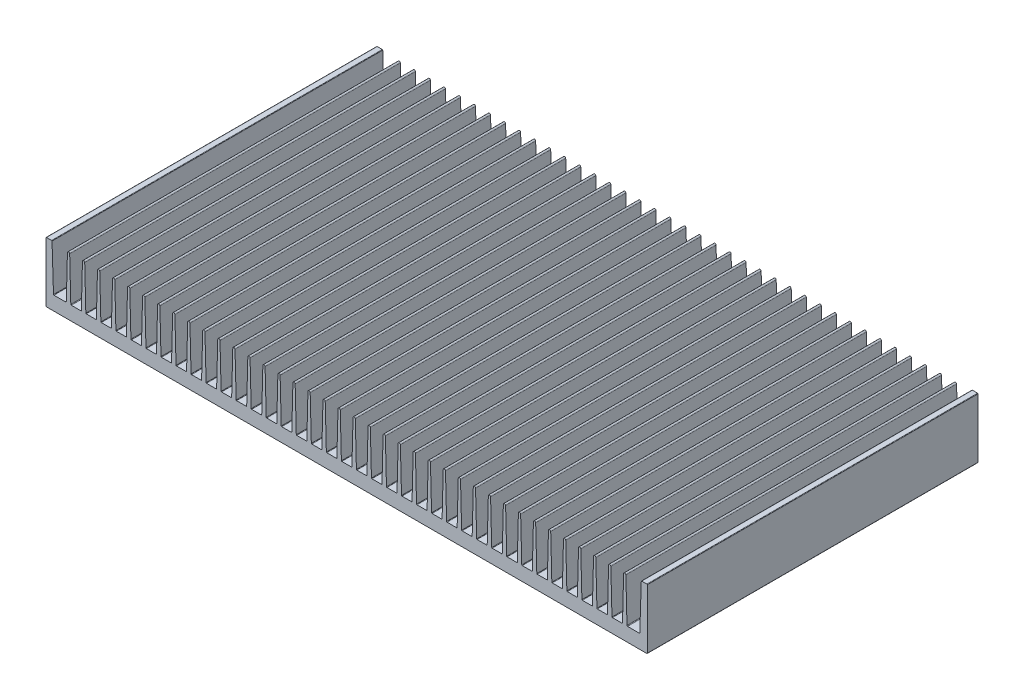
SolidWorks part; units mm, degrees
ref_plane "Vorne" through (0, 0, 0) normal (0, 0, 1) x (1, 0, 0)
ref_plane "Oben" through (0, 0, 0) normal (0, 1, 0) x (1, 0, 0)
ref_plane "Rechts" through (0, 0, 0) normal (1, 0, 0) x (0, 0, -1)
ref_plane "Ebene1" through (0, 0, 10) normal (0, 0, 1) x (1, 0, 0)
sketch "Skizze1" plane through (0, 0, 10) normal (0, 0, 1) x (1, 0, 0)
  line L0 (205.8293, 23.4383) -> (205.0866, 52.2154)
  line L1 (203.5871, 52.2154) -> (202.8444, 23.4383)
  line L2 (202.5445, 23.146) -> (196.1292, 23.146)
  line L3 (195.8293, 23.4383) -> (195.0866, 52.2154)
  line L4 (193.5871, 52.2154) -> (192.8444, 23.4383)
  line L5 (192.5445, 23.146) -> (186.1292, 23.146)
  line L6 (185.8293, 23.4383) -> (185.0866, 52.2154)
  line L7 (183.5871, 52.2154) -> (182.8444, 23.4383)
  line L8 (182.5445, 23.146) -> (176.1292, 23.146)
  line L9 (175.8293, 23.4383) -> (175.0866, 52.2154)
  line L10 (173.5871, 52.2154) -> (172.8444, 23.4383)
  line L11 (172.5445, 23.146) -> (166.1292, 23.146)
  line L12 (165.8293, 23.4383) -> (165.0866, 52.2154)
  line L13 (163.5871, 52.2154) -> (162.8444, 23.4383)
  line L14 (162.5445, 23.146) -> (156.1292, 23.146)
  line L15 (155.8293, 23.4383) -> (155.0866, 52.2154)
  line L16 (153.5871, 52.2154) -> (152.8444, 23.4383)
  line L17 (152.5445, 23.146) -> (146.1292, 23.146)
  line L18 (145.8293, 23.4383) -> (145.0866, 52.2154)
  line L19 (143.5871, 52.2154) -> (142.8444, 23.4383)
  line L20 (142.5445, 23.146) -> (136.1292, 23.146)
  line L21 (135.8293, 23.4383) -> (135.0866, 52.2154)
  line L22 (133.5871, 52.2154) -> (132.8444, 23.4383)
  line L23 (132.5445, 23.146) -> (126.1292, 23.146)
  line L24 (125.8293, 23.4383) -> (125.0866, 52.2154)
  line L25 (123.5871, 52.2154) -> (122.8444, 23.4383)
  line L26 (122.5445, 23.146) -> (116.1292, 23.146)
  line L27 (115.8293, 23.4383) -> (115.0866, 52.2154)
  line L28 (113.5871, 52.2154) -> (112.8444, 23.4383)
  line L29 (112.5445, 23.146) -> (106.1292, 23.146)
  line L30 (105.8293, 23.4383) -> (105.0866, 52.2155)
  line L31 (103.5871, 52.2154) -> (102.8444, 23.4383)
  line L32 (102.5445, 23.146) -> (96.1292, 23.146)
  line L33 (95.8293, 23.4383) -> (95.0866, 52.2154)
  line L34 (93.5871, 52.2154) -> (92.8444, 23.4383)
  line L35 (92.5445, 23.146) -> (86.1292, 23.146)
  line L36 (85.8293, 23.4383) -> (85.0866, 52.2154)
  line L37 (83.5871, 52.2154) -> (82.8444, 23.4383)
  line L38 (82.5445, 23.146) -> (76.1292, 23.146)
  line L39 (75.8293, 23.4383) -> (75.0866, 52.2154)
  line L40 (73.5871, 52.2154) -> (72.8444, 23.4383)
  line L41 (72.5445, 23.146) -> (66.1292, 23.146)
  line L42 (65.8293, 23.4383) -> (65.0866, 52.2154)
  line L43 (63.5871, 52.2154) -> (62.8444, 23.4383)
  line L44 (62.5445, 23.146) -> (56.1292, 23.146)
  line L45 (55.8293, 23.4383) -> (55.0866, 52.2154)
  line L46 (53.5871, 52.2154) -> (52.8444, 23.4383)
  line L47 (52.5445, 23.146) -> (46.1292, 23.146)
  line L48 (45.8293, 23.4383) -> (45.0866, 52.2154)
  line L49 (43.5871, 52.2154) -> (42.8444, 23.4383)
  line L50 (42.5445, 23.146) -> (36.1292, 23.146)
  line L51 (35.8293, 23.4383) -> (35.0866, 52.2154)
  line L52 (33.5871, 52.2154) -> (32.8444, 23.4383)
  line L53 (32.5445, 23.146) -> (26.1292, 23.146)
  line L54 (25.8293, 23.4383) -> (25.0866, 52.2154)
  line L55 (23.5871, 52.2154) -> (22.8444, 23.4383)
  line L56 (22.5445, 23.146) -> (16.2009, 23.146)
  line L57 (15.8275, 23.5099) -> (15.0866, 52.2154)
  line L58 (13.5871, 52.2154) -> (12.8572, 23.9327)
  line L59 (12.05, 23.146) -> (4.6273, 23.146)
  line L60 (4.3275, 23.4363) -> (3.3463, 53.6557)
  line L61 (3.0465, 53.946) -> (-0.3631, 53.946)
  line L62 (-0.6631, 53.646) -> (-0.6631, 14.246)
  line L63 (-0.3631, 13.946) -> (399.0369, 13.946)
  line L64 (399.3369, 14.246) -> (399.3369, 53.6561)
  line L65 (399.037, 53.9561) -> (395.6273, 53.9561)
  line L66 (395.3275, 53.6658) -> (394.3495, 23.533)
  line L67 (393.9497, 23.146) -> (386.2267, 23.146)
  line L68 (385.8268, 23.5357) -> (385.0866, 52.2154)
  line L69 (383.5871, 52.2154) -> (382.8469, 23.5352)
  line L70 (382.4471, 23.1455) -> (376.1293, 23.1455)
  line L71 (375.8294, 23.4378) -> (375.0866, 52.2154)
  line L72 (373.5871, 52.2154) -> (372.8444, 23.4383)
  line L73 (372.5445, 23.146) -> (366.1292, 23.146)
  line L74 (365.8293, 23.4383) -> (365.0866, 52.2154)
  line L75 (363.5871, 52.2154) -> (362.8444, 23.4383)
  line L76 (362.5445, 23.146) -> (356.1292, 23.146)
  line L77 (355.8293, 23.4383) -> (355.0866, 52.2154)
  line L78 (353.5871, 52.2154) -> (352.8444, 23.4383)
  line L79 (352.5445, 23.146) -> (346.1292, 23.146)
  line L80 (345.8293, 23.4383) -> (345.0866, 52.2154)
  line L81 (343.5871, 52.2154) -> (342.8444, 23.4383)
  line L82 (342.5445, 23.146) -> (336.1292, 23.146)
  line L83 (335.8293, 23.4383) -> (335.0866, 52.2154)
  line L84 (333.5871, 52.2154) -> (332.8444, 23.4383)
  line L85 (332.5445, 23.146) -> (326.1292, 23.146)
  line L86 (325.8293, 23.4383) -> (325.0866, 52.2154)
  line L87 (323.5871, 52.2154) -> (322.8444, 23.4383)
  line L88 (322.5445, 23.146) -> (316.1292, 23.146)
  line L89 (315.8293, 23.4383) -> (315.0866, 52.2154)
  line L90 (313.5871, 52.2154) -> (312.8444, 23.4383)
  line L91 (312.5445, 23.146) -> (306.1292, 23.146)
  line L92 (305.8293, 23.4383) -> (305.0866, 52.2154)
  line L93 (303.5871, 52.2154) -> (302.8444, 23.4383)
  line L94 (302.5445, 23.146) -> (296.1292, 23.146)
  line L95 (295.8293, 23.4383) -> (295.0866, 52.2154)
  line L96 (293.5871, 52.2154) -> (292.8444, 23.4383)
  line L97 (292.5445, 23.146) -> (286.1292, 23.146)
  line L98 (285.8293, 23.4383) -> (285.0866, 52.2154)
  line L99 (283.5871, 52.2154) -> (282.8444, 23.4383)
  line L100 (282.5445, 23.146) -> (276.1292, 23.146)
  line L101 (275.8293, 23.4383) -> (275.0866, 52.2154)
  line L102 (273.5871, 52.2154) -> (272.8444, 23.4383)
  line L103 (272.5445, 23.146) -> (266.1292, 23.146)
  line L104 (265.8293, 23.4383) -> (265.0866, 52.2154)
  line L105 (263.5871, 52.2154) -> (262.8444, 23.4383)
  line L106 (262.5445, 23.146) -> (256.1292, 23.146)
  line L107 (255.8293, 23.4383) -> (255.0866, 52.2154)
  line L108 (253.5871, 52.2154) -> (252.8444, 23.4383)
  line L109 (252.5445, 23.146) -> (246.1292, 23.146)
  line L110 (245.8293, 23.4383) -> (245.0866, 52.2154)
  line L111 (243.5871, 52.2154) -> (242.8444, 23.4383)
  line L112 (242.5445, 23.146) -> (236.1292, 23.146)
  line L113 (235.8293, 23.4383) -> (235.0866, 52.2154)
  line L114 (233.5871, 52.2154) -> (232.8444, 23.4383)
  line L115 (232.5445, 23.146) -> (226.1292, 23.146)
  line L116 (225.8293, 23.4383) -> (225.0866, 52.2154)
  line L117 (223.5871, 52.2154) -> (222.8444, 23.4383)
  line L118 (222.5445, 23.146) -> (216.1292, 23.146)
  line L119 (215.8293, 23.4383) -> (215.0866, 52.2154)
  line L120 (213.5871, 52.2154) -> (212.8444, 23.4383)
  line L121 (212.5445, 23.146) -> (206.1292, 23.146)
  arc A0 (205.0866, 52.2154) -> (203.5871, 52.2154) centre (204.3369, 52.196) ccw
  arc A1 (202.8444, 23.4383) -> (202.5445, 23.146) centre (202.5445, 23.446) cw
  arc A2 (196.1292, 23.146) -> (195.8293, 23.4383) centre (196.1292, 23.446) cw
  arc A3 (195.0866, 52.2154) -> (193.5871, 52.2154) centre (194.3369, 52.196) ccw
  arc A4 (192.8444, 23.4383) -> (192.5445, 23.146) centre (192.5445, 23.446) cw
  arc A5 (186.1292, 23.146) -> (185.8293, 23.4383) centre (186.1292, 23.446) cw
  arc A6 (185.0866, 52.2154) -> (183.5871, 52.2154) centre (184.3369, 52.196) ccw
  arc A7 (182.8444, 23.4383) -> (182.5445, 23.146) centre (182.5445, 23.446) cw
  arc A8 (176.1292, 23.146) -> (175.8293, 23.4383) centre (176.1292, 23.446) cw
  arc A9 (175.0866, 52.2154) -> (173.5871, 52.2154) centre (174.3369, 52.196) ccw
  arc A10 (172.8444, 23.4383) -> (172.5445, 23.146) centre (172.5445, 23.446) cw
  arc A11 (166.1292, 23.146) -> (165.8293, 23.4383) centre (166.1292, 23.446) cw
  arc A12 (165.0866, 52.2154) -> (163.5871, 52.2154) centre (164.3369, 52.196) ccw
  arc A13 (162.8444, 23.4383) -> (162.5445, 23.146) centre (162.5445, 23.446) cw
  arc A14 (156.1292, 23.146) -> (155.8293, 23.4383) centre (156.1292, 23.446) cw
  arc A15 (155.0866, 52.2154) -> (153.5871, 52.2154) centre (154.3369, 52.196) ccw
  arc A16 (152.8444, 23.4383) -> (152.5445, 23.146) centre (152.5445, 23.446) cw
  arc A17 (146.1292, 23.146) -> (145.8293, 23.4383) centre (146.1292, 23.446) cw
  arc A18 (145.0866, 52.2154) -> (143.5871, 52.2154) centre (144.3369, 52.196) ccw
  arc A19 (142.8444, 23.4383) -> (142.5445, 23.146) centre (142.5445, 23.446) cw
  arc A20 (136.1292, 23.146) -> (135.8293, 23.4383) centre (136.1292, 23.446) cw
  arc A21 (135.0866, 52.2154) -> (133.5871, 52.2154) centre (134.3369, 52.196) ccw
  arc A22 (132.8444, 23.4383) -> (132.5445, 23.146) centre (132.5445, 23.446) cw
  arc A23 (126.1292, 23.146) -> (125.8293, 23.4383) centre (126.1292, 23.446) cw
  arc A24 (125.0866, 52.2154) -> (123.5871, 52.2154) centre (124.3369, 52.196) ccw
  arc A25 (122.8444, 23.4383) -> (122.5445, 23.146) centre (122.5445, 23.446) cw
  arc A26 (116.1292, 23.146) -> (115.8293, 23.4383) centre (116.1292, 23.446) cw
  arc A27 (115.0866, 52.2154) -> (113.5871, 52.2154) centre (114.3369, 52.196) ccw
  arc A28 (112.8444, 23.4383) -> (112.5445, 23.146) centre (112.5445, 23.446) cw
  arc A29 (106.1292, 23.146) -> (105.8293, 23.4383) centre (106.1292, 23.446) cw
  arc A30 (105.0866, 52.2155) -> (103.5871, 52.2154) centre (104.3369, 52.196) ccw
  arc A31 (102.8444, 23.4383) -> (102.5445, 23.146) centre (102.5445, 23.446) cw
  arc A32 (96.1292, 23.146) -> (95.8293, 23.4383) centre (96.1292, 23.446) cw
  arc A33 (95.0866, 52.2154) -> (93.5871, 52.2154) centre (94.3369, 52.196) ccw
  arc A34 (92.8444, 23.4383) -> (92.5445, 23.146) centre (92.5445, 23.446) cw
  arc A35 (86.1292, 23.146) -> (85.8293, 23.4383) centre (86.1292, 23.446) cw
  arc A36 (85.0866, 52.2154) -> (83.5871, 52.2154) centre (84.3369, 52.196) ccw
  arc A37 (82.8444, 23.4383) -> (82.5445, 23.146) centre (82.5445, 23.446) cw
  arc A38 (76.1292, 23.146) -> (75.8293, 23.4383) centre (76.1292, 23.446) cw
  arc A39 (75.0866, 52.2154) -> (73.5871, 52.2154) centre (74.3369, 52.196) ccw
  arc A40 (72.8444, 23.4383) -> (72.5445, 23.146) centre (72.5445, 23.446) cw
  arc A41 (66.1292, 23.146) -> (65.8293, 23.4383) centre (66.1292, 23.446) cw
  arc A42 (65.0866, 52.2154) -> (63.5871, 52.2154) centre (64.3369, 52.196) ccw
  arc A43 (62.8444, 23.4383) -> (62.5445, 23.146) centre (62.5445, 23.446) cw
  arc A44 (56.1292, 23.146) -> (55.8293, 23.4383) centre (56.1292, 23.446) cw
  arc A45 (55.0866, 52.2154) -> (53.5871, 52.2154) centre (54.3369, 52.196) ccw
  arc A46 (52.8444, 23.4383) -> (52.5445, 23.146) centre (52.5445, 23.446) cw
  arc A47 (46.1292, 23.146) -> (45.8293, 23.4383) centre (46.1292, 23.446) cw
  arc A48 (45.0866, 52.2154) -> (43.5871, 52.2154) centre (44.3369, 52.196) ccw
  arc A49 (42.8444, 23.4383) -> (42.5445, 23.146) centre (42.5445, 23.446) cw
  arc A50 (36.1292, 23.146) -> (35.8293, 23.4383) centre (36.1292, 23.446) cw
  arc A51 (35.0866, 52.2154) -> (33.5871, 52.2154) centre (34.3369, 52.196) ccw
  arc A52 (32.8444, 23.4383) -> (32.5445, 23.146) centre (32.5445, 23.446) cw
  arc A53 (26.1292, 23.146) -> (25.8293, 23.4383) centre (26.1292, 23.446) cw
  arc A54 (25.0866, 52.2154) -> (23.5871, 52.2154) centre (24.3369, 52.196) ccw
  arc A55 (22.8444, 23.4383) -> (22.5445, 23.146) centre (22.5445, 23.446) cw
  arc A56 (16.2009, 23.146) -> (15.8275, 23.5099) centre (16.2009, 23.5195) cw
  arc A57 (15.0866, 52.2154) -> (13.5871, 52.2154) centre (14.3369, 52.196) ccw
  arc A58 (12.8572, 23.9327) -> (12.05, 23.146) centre (12.05, 23.9535) cw
  arc A59 (4.6273, 23.146) -> (4.3275, 23.4363) centre (4.6273, 23.446) cw
  arc A60 (3.3463, 53.6557) -> (3.0465, 53.946) centre (3.0465, 53.646) ccw
  arc A61 (-0.3631, 53.946) -> (-0.6631, 53.646) centre (-0.3631, 53.646) ccw
  arc A62 (-0.6631, 14.246) -> (-0.3631, 13.946) centre (-0.3631, 14.246) ccw
  arc A63 (399.0369, 13.946) -> (399.3369, 14.246) centre (399.0369, 14.246) ccw
  arc A64 (399.3369, 53.6561) -> (399.037, 53.9561) centre (399.0369, 53.6561) ccw
  arc A65 (395.6273, 53.9561) -> (395.3275, 53.6658) centre (395.6273, 53.6561) ccw
  arc A66 (394.3495, 23.533) -> (393.9497, 23.146) centre (393.9497, 23.546) cw
  arc A67 (386.2267, 23.146) -> (385.8268, 23.5357) centre (386.2267, 23.546) cw
  arc A68 (385.0866, 52.2154) -> (383.5871, 52.2154) centre (384.3369, 52.196) ccw
  arc A69 (382.8469, 23.5352) -> (382.4471, 23.1455) centre (382.4471, 23.5455) cw
  arc A70 (376.1293, 23.1455) -> (375.8294, 23.4378) centre (376.1293, 23.4455) cw
  arc A71 (375.0866, 52.2154) -> (373.5871, 52.2154) centre (374.3369, 52.196) ccw
  arc A72 (372.8444, 23.4383) -> (372.5445, 23.146) centre (372.5445, 23.446) cw
  arc A73 (366.1292, 23.146) -> (365.8293, 23.4383) centre (366.1292, 23.446) cw
  arc A74 (365.0866, 52.2154) -> (363.5871, 52.2154) centre (364.3369, 52.196) ccw
  arc A75 (362.8444, 23.4383) -> (362.5445, 23.146) centre (362.5445, 23.446) cw
  arc A76 (356.1292, 23.146) -> (355.8293, 23.4383) centre (356.1292, 23.446) cw
  arc A77 (355.0866, 52.2154) -> (353.5871, 52.2154) centre (354.3369, 52.196) ccw
  arc A78 (352.8444, 23.4383) -> (352.5445, 23.146) centre (352.5445, 23.446) cw
  arc A79 (346.1292, 23.146) -> (345.8293, 23.4383) centre (346.1292, 23.446) cw
  arc A80 (345.0866, 52.2154) -> (343.5871, 52.2154) centre (344.3369, 52.196) ccw
  arc A81 (342.8444, 23.4383) -> (342.5445, 23.146) centre (342.5445, 23.446) cw
  arc A82 (336.1292, 23.146) -> (335.8293, 23.4383) centre (336.1292, 23.446) cw
  arc A83 (335.0866, 52.2154) -> (333.5871, 52.2154) centre (334.3369, 52.196) ccw
  arc A84 (332.8444, 23.4383) -> (332.5445, 23.146) centre (332.5445, 23.446) cw
  arc A85 (326.1292, 23.146) -> (325.8293, 23.4383) centre (326.1292, 23.446) cw
  arc A86 (325.0866, 52.2154) -> (323.5871, 52.2154) centre (324.3369, 52.196) ccw
  arc A87 (322.8444, 23.4383) -> (322.5445, 23.146) centre (322.5445, 23.446) cw
  arc A88 (316.1292, 23.146) -> (315.8293, 23.4383) centre (316.1292, 23.446) cw
  arc A89 (315.0866, 52.2154) -> (313.5871, 52.2154) centre (314.3369, 52.196) ccw
  arc A90 (312.8444, 23.4383) -> (312.5445, 23.146) centre (312.5445, 23.446) cw
  arc A91 (306.1292, 23.146) -> (305.8293, 23.4383) centre (306.1292, 23.446) cw
  arc A92 (305.0866, 52.2154) -> (303.5871, 52.2154) centre (304.3369, 52.196) ccw
  arc A93 (302.8444, 23.4383) -> (302.5445, 23.146) centre (302.5445, 23.446) cw
  arc A94 (296.1292, 23.146) -> (295.8293, 23.4383) centre (296.1292, 23.446) cw
  arc A95 (295.0866, 52.2154) -> (293.5871, 52.2154) centre (294.3369, 52.196) ccw
  arc A96 (292.8444, 23.4383) -> (292.5445, 23.146) centre (292.5445, 23.446) cw
  arc A97 (286.1292, 23.146) -> (285.8293, 23.4383) centre (286.1292, 23.446) cw
  arc A98 (285.0866, 52.2154) -> (283.5871, 52.2154) centre (284.3369, 52.196) ccw
  arc A99 (282.8444, 23.4383) -> (282.5445, 23.146) centre (282.5445, 23.446) cw
  arc A100 (276.1292, 23.146) -> (275.8293, 23.4383) centre (276.1292, 23.446) cw
  arc A101 (275.0866, 52.2154) -> (273.5871, 52.2154) centre (274.3369, 52.196) ccw
  arc A102 (272.8444, 23.4383) -> (272.5445, 23.146) centre (272.5445, 23.446) cw
  arc A103 (266.1292, 23.146) -> (265.8293, 23.4383) centre (266.1292, 23.446) cw
  arc A104 (265.0866, 52.2154) -> (263.5871, 52.2154) centre (264.3369, 52.196) ccw
  arc A105 (262.8444, 23.4383) -> (262.5445, 23.146) centre (262.5445, 23.446) cw
  arc A106 (256.1292, 23.146) -> (255.8293, 23.4383) centre (256.1292, 23.446) cw
  arc A107 (255.0866, 52.2154) -> (253.5871, 52.2154) centre (254.3369, 52.196) ccw
  arc A108 (252.8444, 23.4383) -> (252.5445, 23.146) centre (252.5445, 23.446) cw
  arc A109 (246.1292, 23.146) -> (245.8293, 23.4383) centre (246.1292, 23.446) cw
  arc A110 (245.0866, 52.2154) -> (243.5871, 52.2154) centre (244.3369, 52.196) ccw
  arc A111 (242.8444, 23.4383) -> (242.5445, 23.146) centre (242.5445, 23.446) cw
  arc A112 (236.1292, 23.146) -> (235.8293, 23.4383) centre (236.1292, 23.446) cw
  arc A113 (235.0866, 52.2154) -> (233.5871, 52.2154) centre (234.3369, 52.196) ccw
  arc A114 (232.8444, 23.4383) -> (232.5445, 23.146) centre (232.5445, 23.446) cw
  arc A115 (226.1292, 23.146) -> (225.8293, 23.4383) centre (226.1292, 23.446) cw
  arc A116 (225.0866, 52.2154) -> (223.5871, 52.2154) centre (224.3369, 52.196) ccw
  arc A117 (222.8444, 23.4383) -> (222.5445, 23.146) centre (222.5445, 23.446) cw
  arc A118 (216.1292, 23.146) -> (215.8293, 23.4383) centre (216.1292, 23.446) cw
  arc A119 (215.0866, 52.2154) -> (213.5871, 52.2154) centre (214.3369, 52.196) ccw
  arc A120 (212.8444, 23.4383) -> (212.5445, 23.146) centre (212.5445, 23.446) cw
  arc A121 (206.1292, 23.146) -> (205.8293, 23.4383) centre (206.1292, 23.446) cw
extrude "Linear austragen1" add sketch "Skizze1" against normal blind 220
